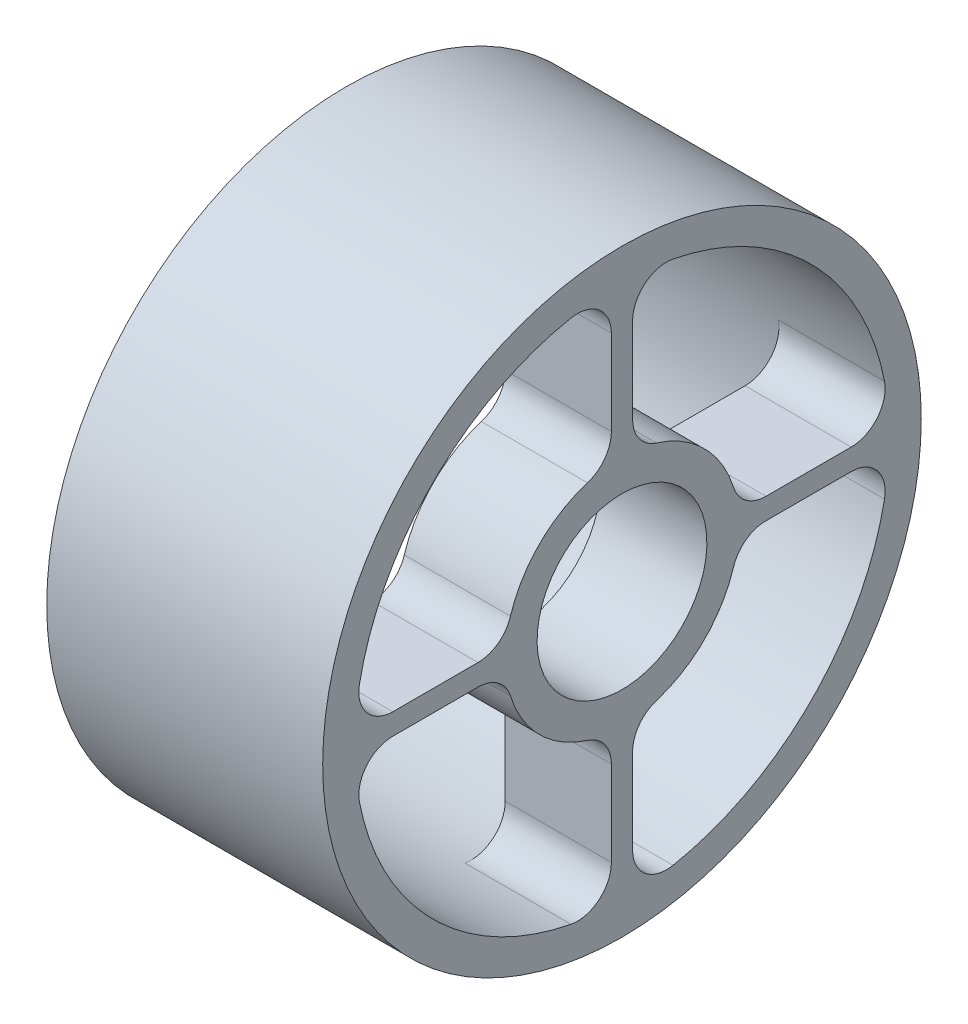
SolidWorks part; units mm, degrees
ref_plane "Front Plane" through (0, 0, 0) normal (0, 0, 1) x (1, 0, 0)
ref_plane "Top Plane" through (0, 0, 0) normal (0, 1, 0) x (1, 0, 0)
ref_plane "Right Plane" through (0, 0, 0) normal (1, 0, 0) x (0, 0, -1)
sketch "Sketch1" plane through (0, 0, 0) normal (0, 0, 1) x (1, 0, 0)
  line L0 (28.047, 34.0995) -> (0, 34.0995)
  line L1 (101.6, 0) -> (0, 0) construction
  line L2 (44, 0) -> (-44, 0) construction
  line L3 (0, 0) -> (0, 34.0995)
  line L4 (0, 29.337) -> (41.275, 29.337)
  line L5 (41.275, 29.337) -> (45.5483, 22.225)
  line L6 (45.5483, 22.225) -> (67.5091, 22.225)
  line L7 (67.5091, 22.225) -> (73.2323, 12.7)
  line L8 (73.2323, 12.7) -> (85.0562, 12.7)
  line L9 (85.0562, 12.7) -> (92.6872, 0)
  line L10 (41.275, 29.337) -> (41.275, 33.2347) construction
  line L11 (67.5091, 22.225) -> (67.5091, 26.1227) construction
  line L12 (85.0562, 12.7) -> (85.0562, 16.5977) construction
  line L13 (0, -44) -> (0, 44) construction
  line L14 (0, 34.0995) -> (-43.0496, 34.0995)
  line L15 (-43.0496, 34.0995) -> (-101.8443, 12.7)
  line L16 (0, 20.0025) -> (-41.91, 20.0025)
  line L17 (-41.91, 20.0025) -> (-46.2978, 12.7)
  line L18 (-46.2978, 12.7) -> (-84.3978, 12.7)
  line L19 (-84.3978, 12.7) -> (-91.1274, 1.5)
  line L20 (-91.1274, 1.5) -> (-117.7193, 1.5)
  line L21 (-101.8443, 12.7) -> (-117.7193, 12.7)
  line L22 (-117.7193, 12.7) -> (-117.7193, 1.5)
  line L23 (-84.3978, 12.7) -> (-84.3978, 19.05) construction
  line L24 (-101.8443, 12.7) -> (-101.8443, 44.7625)
  line L25 (-101.8443, 44.7625) -> (-143.1193, 44.7625)
  line L26 (-143.1193, 44.7625) -> (-143.1193, 0)
  line L27 (-143.1193, 0) -> (-117.7193, 0)
  line L28 (-117.7193, 0) -> (-117.7193, 12.7)
  line L29 (-143.1193, 40) -> (-117.7193, 40)
  line L30 (-117.7193, 40) -> (-117.7193, 12.7)
  arc A0 (99.7302, 4.5) -> (28.047, 34.0995) centre (28.047, -67.5005) ccw
  arc A1 (101.6, 0) -> (99.7302, 4.5) centre (95.25, 0) ccw
  dimension "D1" = 6.35
  dimension "D2" = 95.25
  dimension "D6" = 101.6
  dimension "D3" = 29.337
  dimension "D4" = 4.7625
  dimension "D5" = 41.275
  dimension "D7" = 59
  dimension "D8" = 12.7
  dimension "D9" = 22.225
  dimension "D10" = 20
  dimension "D11" = 41.91
  dimension "D12" = 20.0025
  dimension "D13" = 59
  dimension "D14" = 12.7
  dimension "D15" = 38.1
  dimension "D16" = 1.5
  dimension "D17" = 6.35
  dimension "D18" = 15.875
  dimension "D19" = 12.7
  dimension "D20" = 25.4
  dimension "D21" = 4.7625
  dimension "D22" = 40
revolve "Revolve2" add sketch "Sketch1" angle 360 about L1
sketch "Sketch2" plane through (-101.8443, 0, 0) normal (1, 0, 0) x (0, 0, -1)
  line L0 (-1.5875, 17.3902) -> (-1.5875, 39.9685)
  line L1 (1.5875, 17.3902) -> (1.5875, 39.9685)
  line L2 (17.3902, 1.5875) -> (39.9685, 1.5875)
  line L3 (17.3902, -1.5875) -> (39.9685, -1.5875)
  line L4 (-17.3902, 1.5875) -> (-39.9685, 1.5875)
  line L5 (-17.3902, -1.5875) -> (-39.9685, -1.5875)
  line L6 (-1.5875, -17.3902) -> (-1.5875, -39.9685)
  line L7 (1.5875, -17.3902) -> (1.5875, -39.9685)
  line L8 (49.2387, 0) -> (-49.2387, 0) construction
  line L9 (0, 49.2388) -> (0, -49.2388) construction
  circle A0 centre (0, 0) radius 40 construction
  circle A1 centre (0, 0) radius 44.7625 construction
  circle A2 centre (0, 0) radius 44.7625
  arc A3 (-1.5875, 39.9685) -> (-39.9685, 1.5875) centre (0, 0) ccw
  arc A4 (-1.5875, 17.3902) -> (-17.3902, 1.5875) centre (0, 0) ccw
  circle A6 centre (0, 0) radius 17.4625 construction
  circle A7 centre (0, 0) radius 12.7 construction
  arc A8 (-17.3902, -1.5875) -> (-1.5875, -17.3902) centre (0, 0) ccw
  arc A9 (-39.9685, -1.5875) -> (-1.5875, -39.9685) centre (0, 0) ccw
  arc A10 (1.5875, -17.3902) -> (17.3902, -1.5875) centre (0, 0) ccw
  arc A11 (1.5875, -39.9685) -> (39.9685, -1.5875) centre (0, 0) ccw
  arc A12 (17.3902, 1.5875) -> (1.5875, 17.3902) centre (0, 0) ccw
  arc A13 (39.9685, 1.5875) -> (1.5875, 39.9685) centre (0, 0) ccw
  dimension "D1" = 4.7625
  dimension "D2" = 4.7625
  dimension "D3" = 1.5875
  dimension "D4" = 3.175
  dimension "D5" = 1.5875
  dimension "D6" = 3.175
extrude "Cut-Extrude4" cut sketch "Sketch2" against normal through all contours L5 A9 L6 A8 | A4 L0 A3 L4 | L2 A13 L1 A12 | L7 A11 L3 A10
fillet "Fillet1" radius 5.08 16 edges at (-109.7818, -1.5875, -39.9685) (-109.7818, 1.5875, -39.9685) (-109.7818, -1.5875, -17.3902) (-109.7818, 1.5875, -17.3902) (-109.7818, -39.9685, 1.5875) (-109.7818, -39.9685, -1.5875) (-109.7818, -17.3902, 1.5875) (-109.7818, -17.3902, -1.5875) (-109.7818, 1.5875, 39.9685) (-109.7818, -1.5875, 39.9685) (-109.7818, -1.5875, 17.3902) (-109.7818, 1.5875, 17.3902) (-109.7818, 39.9685, 1.5875) (-109.7818, 17.3902, 1.5875) (-109.7818, 17.3902, -1.5875) (-109.7818, 39.9685, -1.5875)
